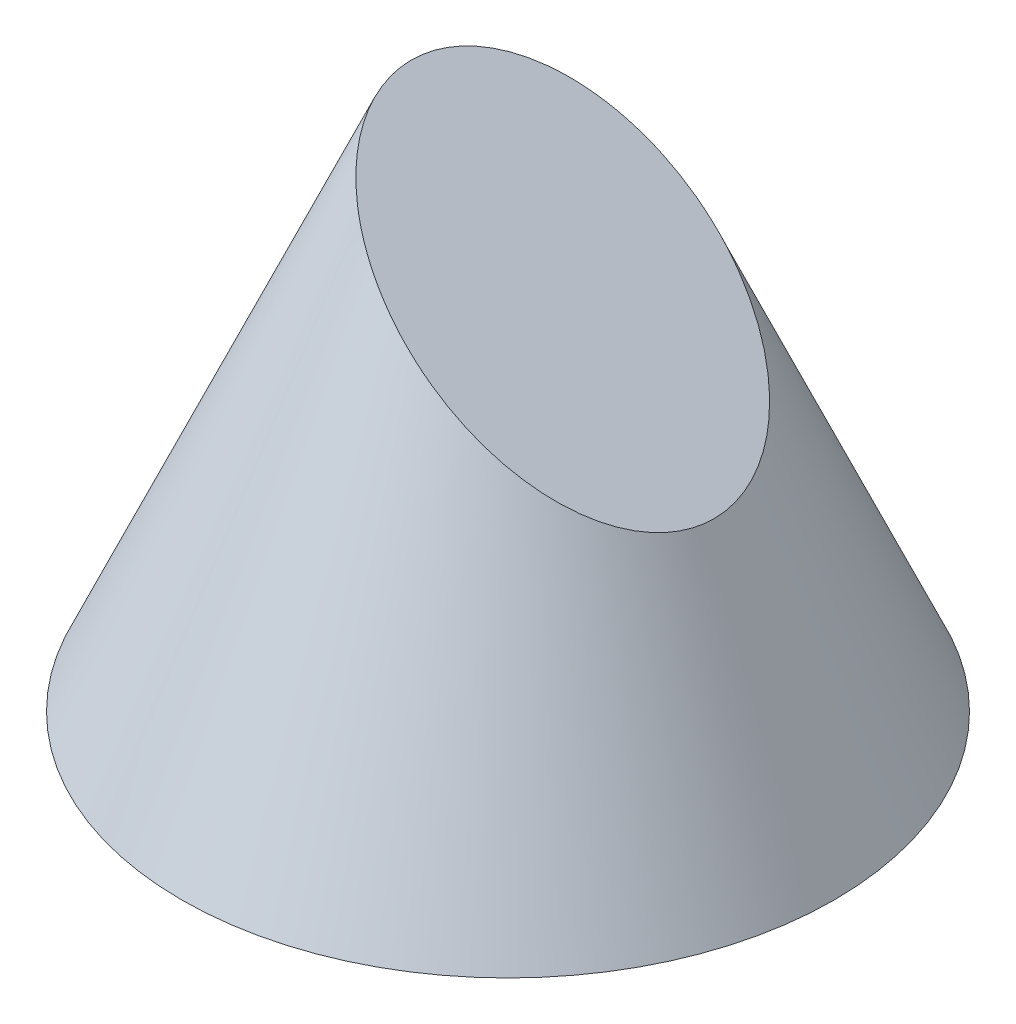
SolidWorks part; units mm, degrees
ref_plane "Front Plane" through (0, 0, 0) normal (0, 0, 1) x (1, 0, 0)
ref_plane "Top Plane" through (0, 0, 0) normal (0, 1, 0) x (1, 0, 0)
ref_plane "Right Plane" through (0, 0, 0) normal (1, 0, 0) x (0, 0, -1)
sketch "Sketch1" plane through (0, 0, 0) normal (0, 1, 0) x (1, 0, 0)
  circle A0 centre (0, 0) radius 18.4678
extrude "Extrude1" add sketch "Sketch1" along normal blind 80 draft 24
sketch "Sketch2" plane through (0, 0, 0) normal (0, 0, 1) x (1, 0, 0)
  line L0 (-7.8215, 31.1185) -> (19.4038, 8.9933)
extrude "Cut-Extrude1" cut sketch "Sketch2" against normal through all and the other way through all
